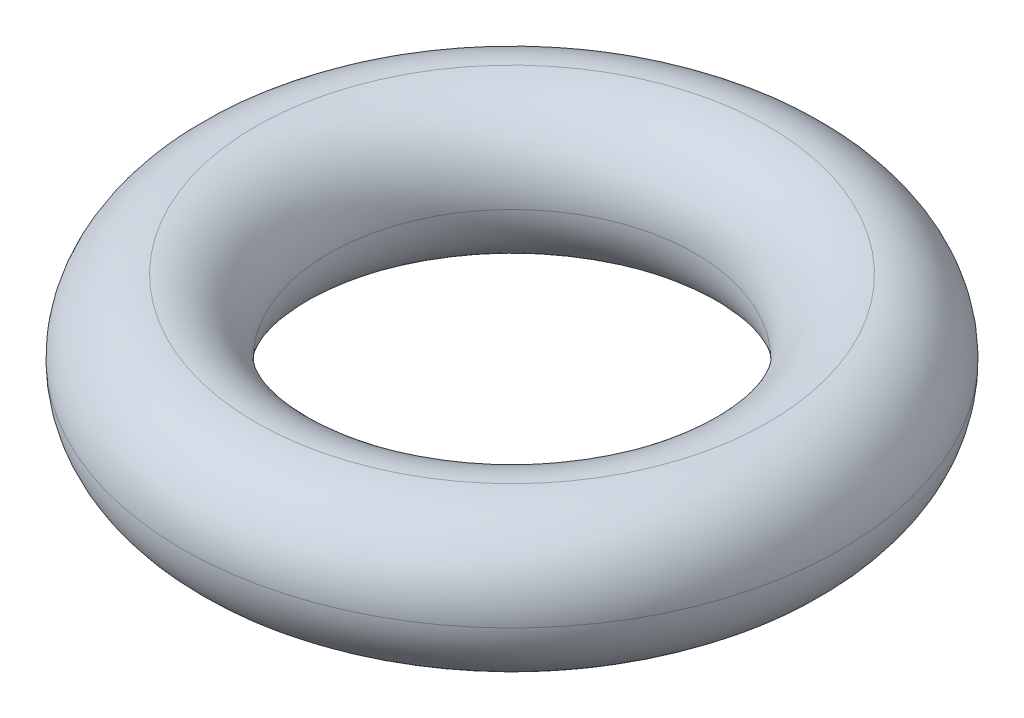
SolidWorks part; units mm, degrees
ref_plane "Front Plane" through (0, 0, 0) normal (0, 0, 1) x (1, 0, 0)
ref_plane "Top Plane" through (0, 0, 0) normal (0, 1, 0) x (1, 0, 0)
ref_plane "Right Plane" through (0, 0, 0) normal (1, 0, 0) x (0, 0, -1)
sketch "Sketch1" plane through (0, 0, 0) normal (0, 1, 0) x (1, 0, 0)
  circle A0 centre (0, 0) radius 7.5
  circle A1 centre (0, 0) radius 13.5
  dimension "D1" = 6
  dimension "D2" = 15
extrude "Boss-Extrude1" add sketch "Sketch1" along normal blind 6
fillet "Fillet1" radius 3 4 edges at (0, 6, 13.5) (0, 0, 7.5) (0, 6, 7.5) (0, 0, 13.5)
